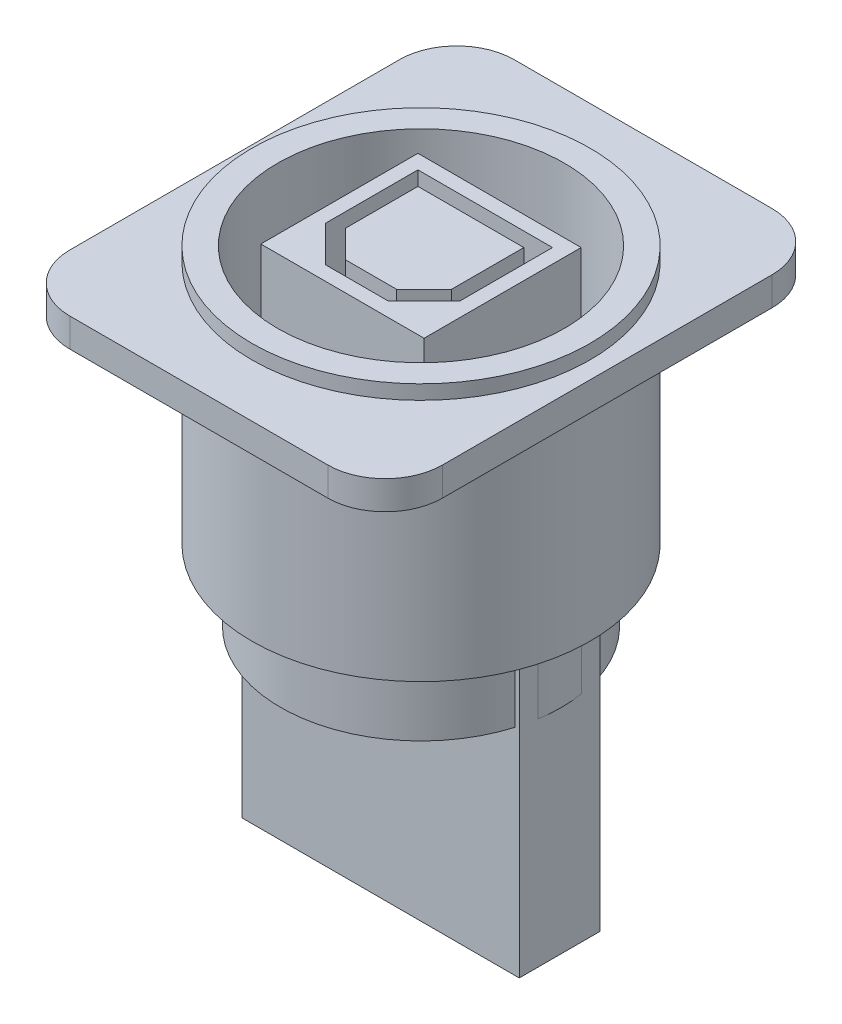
SolidWorks part; units mm, degrees
ref_plane "Alzado" through (0, 0, 0) normal (0, 0, 1) x (1, 0, 0)
ref_plane "Planta" through (0, 0, 0) normal (0, 1, 0) x (1, 0, 0)
ref_plane "Vista lateral" through (0, 0, 0) normal (1, 0, 0) x (0, 0, -1)
sketch "Croquis1" plane through (0, 0, 0) normal (0, 1, 0) x (1, 0, 0)
  circle A0 centre (0, 0) radius 11.8
  dimension "D1" = 23.6
extrude "Saliente-Extruir1" add sketch "Croquis1" along normal blind 18
sketch "Croquis2" plane through (0, 18, 0) normal (0, 1, 0) x (1, 0, 0)
  line L1 (-13, -15.5) -> (13, -15.5)
  line L2 (-13, -15.5) -> (-13, 15.5)
  line L3 (-13, 15.5) -> (13, 15.5)
  line L4 (13, -15.5) -> (13, 15.5)
  line L5 (-13, -15.5) -> (13, 15.5) construction
  line L6 (-13, 15.5) -> (13, -15.5) construction
  point P0 (0, 0)
  dimension "D1" = 26
  dimension "D2" = 31
extrude "Saliente-Extruir2" add sketch "Croquis2" along normal blind 2 from offset 3 contours L2 L1 L4 L3
fillet "Redondeo1" radius 4 4 edges at (13, 16, 15.5) (13, 16, -15.5) (-13, 16, -15.5) (-13, 16, 15.5)
sketch "Croquis3" plane through (0, 18, 0) normal (0, 1, 0) x (1, 0, 0)
  circle A0 centre (0, 0) radius 10
  dimension "D1" = 20
extrude "Cortar-Extruir1" cut sketch "Croquis3" against normal blind 10
sketch "Croquis4" plane through (0, 8, 0) normal (0, 1, 0) x (1, 0, 0)
  line L1 (-5.695, -5.4814) -> (5.695, -5.4814)
  line L2 (-5.695, -5.4814) -> (-5.695, 5.4814)
  line L3 (-5.695, 5.4814) -> (5.695, 5.4814)
  line L4 (5.695, -5.4814) -> (5.695, 5.4814)
  line L5 (-5.695, -5.4814) -> (5.695, 5.4814) construction
  line L6 (-5.695, 5.4814) -> (5.695, -5.4814) construction
  point P0 (0, 0)
extrude "Saliente-Extruir3" add sketch "Croquis4" along normal up to surface (10 mm away)
sketch "Croquis5" plane through (0, 18, 0) normal (0, 1, 0) x (1, 0, 0)
  line L0 (-5.695, 5.4814) -> (-5.695, -5.4814) construction
  line L1 (-4.695, -4.4814) -> (4.695, -4.4814)
  line L2 (-4.695, -4.4814) -> (-4.695, 4.4814)
  line L3 (-4.695, 4.4814) -> (4.695, 4.4814)
  line L4 (4.695, -4.4814) -> (4.695, 4.4814)
  line L5 (-4.695, -4.4814) -> (4.695, 4.4814) construction
  line L6 (-4.695, 4.4814) -> (4.695, -4.4814) construction
  line L7 (5.695, 5.4814) -> (-5.695, 5.4814) construction
  point P0 (0, 0)
  dimension "D1" = 1
  dimension "D2" = 1
extrude "Cortar-Extruir2" cut sketch "Croquis5" against normal blind 10
chamfer "Chaflán1" distance 2.5 angle 45 2 edges at (4.695, 13, 4.4814) (-4.695, 13, 4.4814)
sketch "Croquis6" plane through (0, 8, 0) normal (0, 1, 0) x (1, 0, 0)
  line L18 (-1.7808, -3.4814) -> (1.7808, -3.4814)
  line L19 (1.7808, -3.4814) -> (3.695, -1.5672)
  line L20 (3.695, -1.5672) -> (3.695, 3.4814)
  line L21 (3.695, 3.4814) -> (-3.695, 3.4814)
  line L22 (-3.695, 3.4814) -> (-3.695, -1.5672)
  line L23 (-3.695, -1.5672) -> (-1.7808, -3.4814)
  line L24 (-1.7808, -3.4814) -> (1.7808, -3.4814)
  line L25 (1.7808, -3.4814) -> (3.695, -1.5672)
  line L26 (3.695, -1.5672) -> (3.695, 3.4814)
  line L27 (3.695, 3.4814) -> (-3.695, 3.4814)
  line L28 (-3.695, 3.4814) -> (-3.695, -1.5672)
  line L29 (-3.695, -1.5672) -> (-1.7808, -3.4814)
  dimension "D1" = 1
extrude "Saliente-Extruir4" add sketch "Croquis6" along normal up to surface (10 mm away)
sketch "Croquis7" plane through (0, 0, 0) normal (0, -1, 0) x (1, 0, 0)
  line L1 (-9.6814, -2.8238) -> (9.6814, -2.8238)
  line L2 (-9.6814, -2.8238) -> (-9.6814, 2.8238)
  line L3 (-9.6814, 2.8238) -> (9.6814, 2.8238)
  line L4 (9.6814, -2.8238) -> (9.6814, 2.8238)
  line L5 (-9.6814, -2.8238) -> (9.6814, 2.8238) construction
  line L6 (-9.6814, 2.8238) -> (9.6814, -2.8238) construction
  point P0 (0, 0)
extrude "Saliente-Extruir5" add sketch "Croquis7" along normal blind 20
sketch "Croquis8" plane through (0, 0, 0) normal (0, -1, 0) x (1, 0, 0)
  circle A2 centre (0, 0) radius 9.8
  circle A3 centre (0, 0) radius 9.8
  dimension "D1" = 2
extrude "Saliente-Extruir6" add sketch "Croquis8" along normal blind 5
sketch "Croquis9" plane through (0, -20, 0) normal (0, -1, 0) x (1, 0, 0)
  line L0 (0, -17.05) -> (0, 17.05) construction
  line L1 (-8.9221, -1.2576) -> (8.9221, -1.2576)
  line L2 (-8.9221, -1.2576) -> (-8.9221, 2.1593)
  line L3 (-8.9221, 2.1593) -> (8.9221, 2.1593)
  line L4 (8.9221, -1.2576) -> (8.9221, 2.1593)
  line L5 (-8.9221, -1.2576) -> (8.9221, 2.1593) construction
  line L6 (-8.9221, 2.1593) -> (8.9221, -1.2576) construction
  point P0 (0, 0.4509)
extrude "Cortar-Extruir3" cut sketch "Croquis9" against normal blind 10
